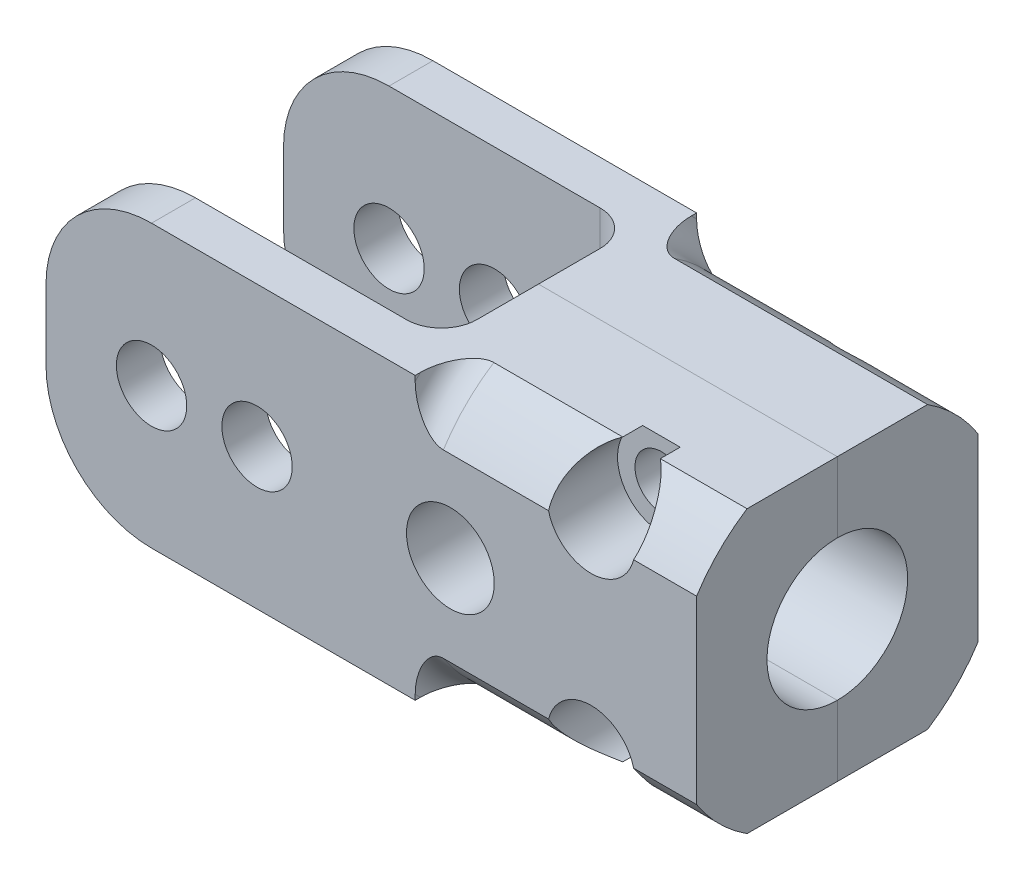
SolidWorks part; units mm, degrees
ref_plane "Front Plane" through (0, 0, 0) normal (0, 0, 1) x (1, 0, 0)
ref_plane "Top Plane" through (0, 0, 0) normal (0, 1, 0) x (1, 0, 0)
ref_plane "Right Plane" through (0, 0, 0) normal (1, 0, 0) x (0, 0, -1)
sketch "Sketch1" plane through (0, 0, 0) normal (0, 0, 1) x (1, 0, 0)
  line L0 (0, 0) -> (49.1998, 0) construction
  line L1 (0, 0) -> (0, -12.7) construction
  line L2 (0, 0) -> (0, 12.7) construction
  line L3 (0, -12.7) -> (-9.525, -12.7)
  line L4 (-9.525, -12.7) -> (-9.525, 12.7)
  line L5 (22.225, 0) -> (22.225, 12.7) construction
  line L6 (22.225, -12.7) -> (22.225, 0) construction
  line L9 (-9.525, 12.7) -> (0, 12.7)
  line L10 (0, 12.7) -> (49.1998, 12.7)
  line L11 (49.1998, 12.7) -> (49.1998, 0)
  line L12 (49.1998, 0) -> (49.1998, -12.7)
  line L13 (49.1998, -12.7) -> (0, -12.7)
  circle A0 centre (26.9748, 0) radius 3.9624
  circle A1 centre (26.9748, 0) radius 2.3876
  circle A2 centre (39.6748, 9.1186) radius 2.3876
  circle A3 centre (39.6748, 9.1186) radius 3.9624
  circle A4 centre (39.6748, -9.1186) radius 2.3876
  circle A5 centre (39.6748, -9.1186) radius 3.9624
  circle A6 centre (0, 0) radius 3.175
  circle A7 centre (9.525, 0) radius 3.175
  dimension "D5" = 4.7752
  dimension "D6" = 7.9248
  dimension "D11" = 6.35
  dimension "D2" = 25.4
  dimension "D3" = 9.525
  dimension "D4" = 26.9748
  dimension "D7" = 18.2372
  dimension "D8" = 22.225
  dimension "D9" = 12.7
  dimension "D10" = 9.525
  dimension "D12" = 4.7498
  dimension "D13" = 9.525
  dimension "D14" = 17.4498
  dimension "D15" = 26.9748
  dimension "D16" = 12.7
sketch "Sketch2" plane through (0, 0, 0) normal (0, 0, 1) x (1, 0, 0)
  line L0 (49.1998, -12.7) -> (0, -12.7) construction
  line L1 (0, -12.7) -> (-9.525, -12.7) construction
  line L2 (-9.525, -12.7) -> (-9.525, 12.7) construction
  line L3 (-9.525, 12.7) -> (0, 12.7) construction
  line L4 (0, 12.7) -> (49.1998, 12.7) construction
  line L5 (49.1998, 12.7) -> (49.1998, 0) construction
  line L6 (49.1998, 0) -> (49.1998, -12.7) construction
  line L7 (49.1998, -12.7) -> (0, -12.7)
  line L8 (0, -12.7) -> (-9.525, -12.7)
  line L9 (-9.525, -12.7) -> (-9.525, 12.7)
  line L10 (-9.525, 12.7) -> (0, 12.7)
  line L11 (0, 12.7) -> (49.1998, 12.7)
  line L12 (49.1998, 12.7) -> (49.1998, 0)
  line L13 (49.1998, 0) -> (49.1998, -12.7)
  circle A0 centre (0, 0) radius 3.175 construction
  circle A1 centre (26.9748, 0) radius 2.3876 construction
  circle A2 centre (39.6748, -9.1186) radius 2.3876 construction
  circle A3 centre (39.6748, 9.1186) radius 2.3876 construction
  circle A4 centre (0, 0) radius 3.175
  circle A5 centre (26.9748, 0) radius 2.3876
  circle A6 centre (39.6748, -9.1186) radius 2.3876
  circle A7 centre (39.6748, 9.1186) radius 2.3876
extrude "Boss-Extrude1" add sketch "Sketch2" against normal blind 12.7
sketch "Sketch3" plane through (0, 0, 0) normal (0, 0, 1) x (1, 0, 0)
  line L0 (49.1998, -12.7) -> (0, -12.7) construction
  line L1 (0, -12.7) -> (-9.525, -12.7) construction
  line L2 (-9.525, -12.7) -> (-9.525, 12.7) construction
  line L3 (-9.525, 12.7) -> (0, 12.7) construction
  line L4 (0, 12.7) -> (49.1998, 12.7) construction
  line L5 (49.1998, 12.7) -> (49.1998, 0) construction
  line L6 (49.1998, 0) -> (49.1998, -12.7) construction
  line L7 (49.1998, -12.7) -> (0, -12.7)
  line L8 (0, -12.7) -> (-9.525, -12.7)
  line L9 (-9.525, -12.7) -> (-9.525, 12.7)
  line L10 (-9.525, 12.7) -> (0, 12.7)
  line L11 (0, 12.7) -> (49.1998, 12.7)
  line L12 (49.1998, 12.7) -> (49.1998, 0)
  line L13 (49.1998, 0) -> (49.1998, -12.7)
  circle A0 centre (0, 0) radius 3.175 construction
  circle A1 centre (26.9748, 0) radius 2.3876 construction
  circle A2 centre (39.6748, -9.1186) radius 2.3876 construction
  circle A3 centre (39.6748, 9.1186) radius 2.3876 construction
  circle A4 centre (0, 0) radius 3.175
  circle A5 centre (26.9748, 0) radius 2.3876
  circle A6 centre (39.6748, -9.1186) radius 2.3876
  circle A7 centre (39.6748, 9.1186) radius 2.3876
extrude "Boss-Extrude2" add sketch "Sketch3" along normal blind 12.7 separate body
sketch "Sketch4" plane through (0, 0, 0) normal (0, 1, 0) x (1, 0, 0)
  line L0 (22.225, 0) -> (22.225, -8.7376)
  line L1 (22.225, -8.7376) -> (-9.525, -8.7376)
  line L2 (-9.525, -12.7) -> (-9.525, 0) construction
  line L3 (-9.525, -8.7376) -> (-9.525, 8.7376)
  line L4 (-9.525, 12.7) -> (-9.525, 0) construction
  line L5 (-9.525, 8.7376) -> (22.225, 8.7376)
  line L6 (22.225, 8.7376) -> (22.225, 0)
  line L7 (0, 0) -> (12.0172, 0) construction
  line L8 (0, 0) -> (49.1998, 0) construction
  dimension "D1" = 17.4752
extrude "Cut-Extrude1" cut sketch "Sketch4" against normal mid plane 50.8
sketch "Sketch6" plane through (0, 0, 0) normal (0, 0, 1) x (1, 0, 0)
  circle A0 centre (26.9748, 0) radius 3.9624 construction
  circle A1 centre (26.9748, 0) radius 3.9624
extrude "Cut-Extrude3" cut sketch "Sketch6" along normal blind 50.8
sketch "Sketch7" plane through (0, 0, 0) normal (0, 0, 1) x (1, 0, 0)
  circle A0 centre (39.6748, 9.1186) radius 3.9624 construction
  circle A1 centre (39.6748, -9.1186) radius 3.9624 construction
  circle A2 centre (39.6748, 9.1186) radius 3.9624
  circle A3 centre (39.6748, -9.1186) radius 3.9624
extrude "Cut-Extrude4" cut sketch "Sketch7" along normal blind 12.7 from offset 6.35
fillet "Fillet2" radius 3.175 1 edges at (22.225, 0, -8.7376)
fillet "Fillet3" radius 3.175 1 edges at (22.225, 0, 8.7376)
sketch "Sketch5" plane through (0, 0, 0) normal (1, 0, 0) x (0, 0, -1)
  circle A0 centre (0, 0) radius 6.35
  dimension "D1" = 12.7
extrude "Cut-Extrude2" cut sketch "Sketch5" along normal blind 50.8
sketch "Sketch8" plane through (0, 0, 0) normal (0, 0, 1) x (1, 0, 0)
  circle A0 centre (9.525, 0) radius 3.175 construction
  circle A1 centre (9.525, 0) radius 3.175
extrude "Cut-Extrude5" cut sketch "Sketch8" against normal mid plane 50.8
fillet "Fillet4" radius 9.525 2 edges at (-9.525, -12.7, 10.7188) (-9.525, 12.7, 10.7188)
fillet "Fillet5" radius 9.525 2 edges at (-9.525, -12.7, -10.7188) (-9.525, 12.7, -10.7188)
sketch "Sketch9" plane through (49.1998, 0, 0) normal (1, 0, 0) x (0, 0, -1)
  circle A0 centre (0, 0) radius 15.0876
  dimension "D1" = 30.1752
extrude "Cut-Extrude6" cut sketch "Sketch9" against normal blind 25.4 flip side to cut
fillet "Fillet7" radius 2.54 2 edges at (23.7998, -10.6685, -10.6685) (23.7998, 10.6685, -10.6685)
fillet "Fillet8" radius 2.54 2 edges at (23.7998, -10.6685, 10.6685) (23.7998, 10.6685, 10.6685)
